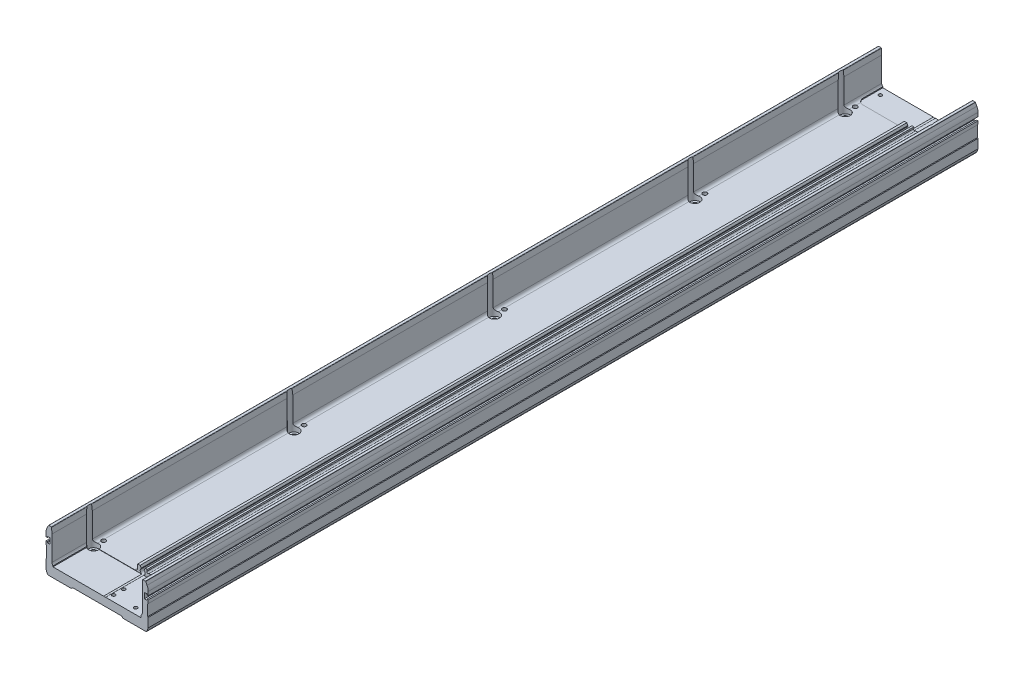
SolidWorks part; units mm, degrees
ref_plane "前视基准面" through (0, 0, 0) normal (0, 0, 1) x (1, 0, 0)
ref_plane "上视基准面" through (0, 0, 0) normal (0, 1, 0) x (1, 0, 0)
ref_plane "右视基准面" through (0, 0, 0) normal (1, 0, 0) x (0, 0, -1)
sketch "草图1" plane through (0, 0, 0) normal (0, 0, 1) x (1, 0, 0)
  line B0 (-58.5, 13.5) -> (-58, 13)
  line B1 (-58, 13) -> (-58, 2)
  line B2 (-58, 2) -> (-58.5, 1.5)
  line B3 (-58.5, 1.5) -> (-58.5, -7.52)
  line B4 (-58.5, -7.52) -> (-57.5319, -10.3374)
  line B5 (-56.5649, -11.8) -> (-33.3, -11.8)
  line B6 (-33.3, -11.8) -> (-32, -10.5)
  line B7 (-32, -10.5) -> (17, -10.5)
  line B8 (17, -10.5) -> (18.3, -11.8)
  line B9 (18.3, -11.8) -> (41.5649, -11.8)
  line B10 (42.5319, -10.3374) -> (43.5, -7.52)
  line B11 (43.5, -7.52) -> (43.5, 1.5)
  line B12 (43.5, 1.5) -> (43, 2)
  line B13 (43, 2) -> (43, 13)
  line B14 (43, 13) -> (43.5, 13.5)
  line B15 (43.5, 13.5) -> (43.5, 16.75)
  line B16 (43.5, 16.75) -> (42.2, 16.75)
  line B17 (42.2, 16.75) -> (42.2, 15.65)
  line B18 (42.2, 15.65) -> (39.6, 15.65)
  line B19 (39.6, 15.65) -> (39.6, 21.35)
  line B20 (39.6, 21.35) -> (42.2, 21.35)
  line B21 (42.2, 21.35) -> (42.2, 20.25)
  line B22 (42.2, 20.25) -> (43.5, 20.25)
  line B23 (43.5, 20.25) -> (43.5, 24.0108)
  line B24 (42.3507, 28.6654) -> (40.9443, 31.3396)
  line B25 (40.6788, 31.5) -> (38.1949, 31.5)
  line B26 (37.8953, 31.2155) -> (37.6, 25.5)
  line B27 (37.6, 25.5) -> (37.6, 2.5)
  line B28 (34.6, -0.5) -> (28.5, -0.5)
  line B29 (28.5, -0.5) -> (26.3, 1.7)
  line B30 (26.3, 1.7) -> (6.0266, 1.7)
  line B31 (4.5, 2.9914) -> (4.5, 4.5)
  line B32 (4.5, 4.5) -> (2.6, 4.5)
  line B33 (2.6, 4.5) -> (1.5, 2.6)
  line B34 (1.5, 2.6) -> (1.5, 2)
  line B35 (-1.5, 2) -> (-1.5, 2.6)
  line B36 (-1.5, 2.6) -> (-2.6, 4.5)
  line B37 (-2.6, 4.5) -> (-5, 4.5)
  line B38 (-5, 4.5) -> (-5, 1)
  line B39 (-8, -2) -> (-49.6, -2)
  line B40 (-52.6, 1) -> (-52.6, 25.5)
  line B41 (-52.6, 25.5) -> (-52.8953, 31.2155)
  line B42 (-53.1949, 31.5) -> (-55.6788, 31.5)
  line B43 (-55.9443, 31.3396) -> (-57.3507, 28.6654)
  line B44 (-58.5, 24.0108) -> (-58.5, 20.25)
  line B45 (-58.5, 20.25) -> (-57.2, 20.25)
  line B46 (-57.2, 20.25) -> (-57.2, 21.35)
  line B47 (-57.2, 21.35) -> (-54.6, 21.35)
  line B48 (-54.6, 21.35) -> (-54.6, 15.65)
  line B49 (-54.6, 15.65) -> (-57.2, 15.65)
  line B50 (-57.2, 15.65) -> (-57.2, 16.75)
  line B51 (-57.2, 16.75) -> (-58.5, 16.75)
  line B52 (-58.5, 16.75) -> (-58.5, 13.5)
  arc B53 (-57.5319, -10.3374) -> (-56.5649, -11.8) centre (-54.2218, -9.2) ccw
  arc B54 (41.5649, -11.8) -> (42.5319, -10.3374) centre (39.2218, -9.2) ccw
  arc B55 (43.5, 24.0108) -> (42.3507, 28.6654) centre (33.5, 24.0108) ccw
  arc B56 (40.9443, 31.3396) -> (40.6788, 31.5) centre (40.6788, 31.2) ccw
  arc B57 (38.1949, 31.5) -> (37.8953, 31.2155) centre (38.1949, 31.2) ccw
  arc B58 (34.6, -0.5) -> (37.6, 2.5) centre (34.6, 2.5) ccw
  arc B59 (4.5, 2.9914) -> (6.0266, 1.7) centre (5.25, 2.33) ccw
  arc B60 (-1.5, 2) -> (1.5, 2) centre (0, 0) ccw
  arc B61 (-8, -2) -> (-5, 1) centre (-8, 1) ccw
  arc B62 (-52.6, 1) -> (-49.6, -2) centre (-49.6, 1) ccw
  arc B63 (-52.8953, 31.2155) -> (-53.1949, 31.5) centre (-53.1949, 31.2) ccw
  arc B64 (-55.6788, 31.5) -> (-55.9443, 31.3396) centre (-55.6788, 31.2) ccw
  arc B65 (-57.3507, 28.6654) -> (-58.5, 24.0108) centre (-48.5, 24.0108) ccw
sketch_block_instance "块1-1"
sketch_block "块1"
extrude "凸台-拉伸1" add sketch "草图1" against normal blind 828
sketch "草图2" plane through (0, 4.5, 0) normal (0, 1, 0) x (1, 0, 0)
  line L0 (-8, 828) -> (-49.6, 828) construction
  line L1 (-51.5, 828) -> (36.5, 828)
  line L2 (-51.5, 828) -> (-51.5, 803)
  line L3 (-51.5, 803) -> (36.5, 803)
  line L4 (36.5, 828) -> (36.5, 803)
  line L5 (-58.5, 828) -> (-58.5, 0) construction
  line L6 (43.5, 828) -> (43.5, 0) construction
  line L7 (-8, 0) -> (-49.6, 0) construction
  line L8 (-51.5, 0) -> (36.5, 0)
  line L9 (-51.5, 0) -> (-51.5, 38)
  line L10 (-51.5, 38) -> (36.5, 38)
  line L11 (36.5, 0) -> (36.5, 38)
  dimension "D1" = 25
  dimension "D2" = 7
  dimension "D3" = 7
  dimension "D4" = 38
extrude "切除-拉伸1" cut sketch "草图2" against normal blind 6.8
fillet "圆角1" radius 5 4 edges at (-51.5, -1.8108, -803) (36.5, -1.0608, -803) (36.5, -1.0608, -38) (-51.5, -1.8108, -38)
hole_wizard "打孔尺寸(%根据)内六角圆柱头螺钉的类型1" positions "草图3" profile "草图4" counterbore size "M5" standard "GB"
sketch "草图3" plane through (0, 31.5, 0) normal (0, 1, 0) x (1, 0, 0)
  line L0 (-58.5, 828) -> (-58.5, 0) construction
  line L1 (43.5, 828) -> (43.5, 0) construction
  line L3 (18.3, 828) -> (41.5649, 828) construction
  point P0 (-48.5, 787.5)
  point P2 (33.5, 787.5)
  point P13 (33.5, 637.5)
  point P15 (-48.5, 637.5)
  point P22 (33.5, 437.5)
  point P24 (-48.5, 437.5)
  point P25 (33.5, 237.5)
  point P27 (-48.5, 237.5)
  point P29 (33.5, 37.5)
  point P31 (-48.5, 37.5)
  point P33 (33.5, -162.5)
  point P35 (-48.5, -162.5)
  dimension "D1" = 10
  dimension "D2" = 10
  dimension "D3" = 40.5
  dimension "D4" = 150
  dimension "D5" = 200
  dimension "D6" = 200
  dimension "D7" = 200
  dimension "D8" = 200
sketch "草图4" plane through (-48.5, 31.5, -787.5) normal (1, 0, 0) x (0, 0, 1)
  line L0 (0, 0) -> (0, 43.3)
  line L1 (0, 43.3) -> (2.75, 43.3)
  line L3 (2.75, 43.3) -> (2.75, 38)
  line L4 (2.75, 38) -> (5, 38)
  line L5 (5, 38) -> (5, 0)
  line L7 (5, 0) -> (0, 0)
  line L11 (0, -6.35) -> (0, 107.95) construction
  dimension "通孔孔直径" = 5.5
  dimension "通孔孔深度" = 43.3
  dimension "柱形沉头孔直径" = 10
  dimension "柱形沉头孔深度" = 38
hole_wizard "M5 螺纹孔1" positions "草图5" profile "草图6" tap size "M5" standard "GB"
sketch "草图5" plane through (0, -11.8, 0) normal (0, -1, 0) x (-1, 0, 0)
  line L0 (48.5, 787.5) -> (48.5, 797.5) construction
  line L1 (-33.5, 787.5) -> (-33.5, 797.5) construction
  line L3 (56.5649, 828) -> (33.3, 828) construction
  point P0 (48.5, 797.5)
  point P2 (-33.5, 797.5)
  point P12 (48.5, 647.5)
  point P14 (-33.5, 647.5)
  point P19 (-33.5, 447.5)
  point P21 (48.5, 447.5)
  point P23 (-33.5, 247.5)
  point P25 (48.5, 247.5)
  point P27 (-33.5, 47.5)
  point P29 (48.5, 47.5)
  point P31 (-33.5, -152.5)
  point P33 (48.5, -152.5)
  dimension "D1" = 30.5
  dimension "D2" = 150
  dimension "D3" = 200
  dimension "D4" = 200
  dimension "D5" = 200
  dimension "D6" = 200
sketch "草图6" plane through (-48.5, -11.8, -797.5) normal (1, 0, 0) x (0, 0, -1)
  line L0 (0, 0) -> (0, 43.3)
  line L1 (0, 43.3) -> (2.1, 43.3)
  line L2 (2.1, 43.3) -> (2.1, 0)
  line L5 (2.1, 0) -> (0, 0)
  line L11 (0, -6.35) -> (0, 107.95) construction
  dimension "通孔螺纹孔钻头直径" = 4.2
  dimension "通孔螺纹孔钻头深度" = 43.3
hole_wizard "M4 螺纹孔1" positions "草图7" profile "草图8" tap size "M4" standard "GB"
sketch "草图7" plane through (0, -2.3, 0) normal (0, 1, 0) x (1, 0, 0)
  line L0 (43.5, 828) -> (43.5, 0) construction
  line L1 (0.9798, 0) -> (36.5, 0) construction
  line L2 (-0.9798, 828) -> (-51.5, 828) construction
  line L3 (-58.5, 828) -> (-58.5, 0) construction
  point P0 (3, 6)
  point P2 (25, 6)
  point P4 (25, 16)
  point P6 (3, 16)
  point P14 (-46.5, 820.5)
  point P16 (31.5, 820.5)
  dimension "D1" = 18.5
  dimension "D2" = 22
  dimension "D3" = 6
  dimension "D4" = 10
  dimension "D5" = 7.5
  dimension "D6" = 12
  dimension "D7" = 78
sketch "草图8" plane through (3, -2.3, -6) normal (1, 0, 0) x (0, 0, 1)
  line L0 (0, 0) -> (0, 9.5)
  line L1 (0, 9.5) -> (1.65, 9.5)
  line L2 (1.65, 9.5) -> (1.65, 0)
  line L5 (1.65, 0) -> (0, 0)
  line L11 (0, -6.35) -> (0, 107.95) construction
  dimension "通孔螺纹孔钻头直径" = 3.3
  dimension "通孔螺纹孔钻头深度" = 9.5
